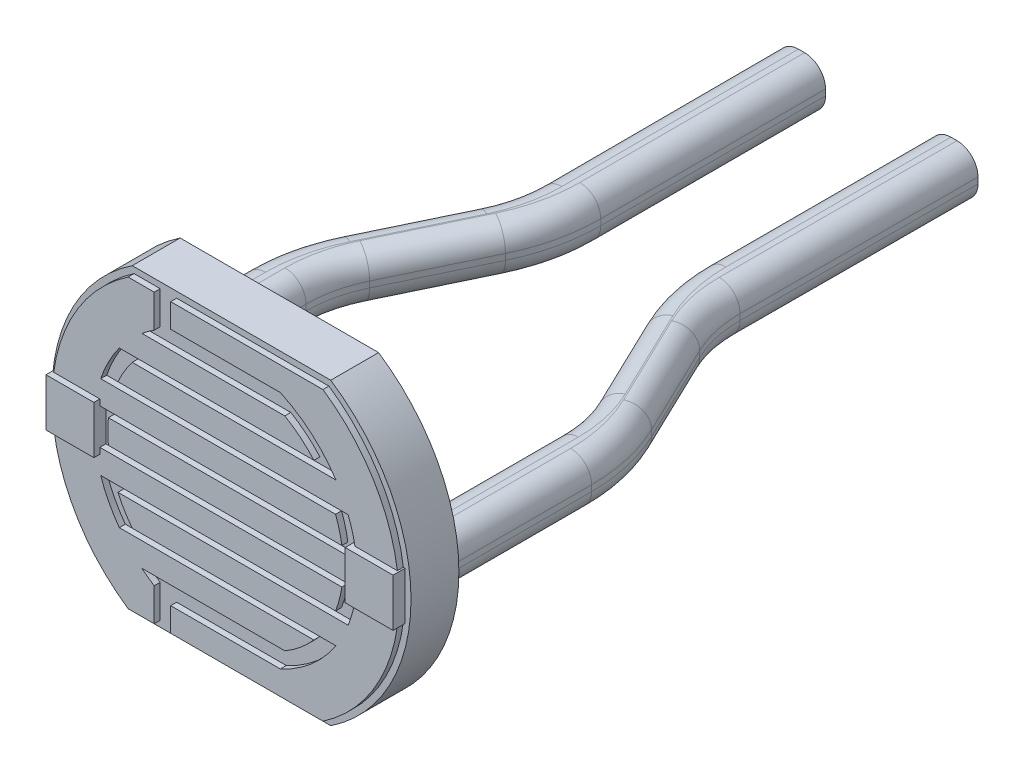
SolidWorks part; units mm, degrees
ref_plane "Face" through (0, 0, 0) normal (0, 0, 1) x (1, 0, 0)
ref_plane "Dessus" through (0, 0, 0) normal (0, 1, 0) x (1, 0, 0)
ref_plane "Droite" through (0, 0, 0) normal (1, 0, 0) x (0, 0, -1)
sketch "Esquisse1" plane through (0, 0, 0) normal (0, 0, 1) x (1, 0, 0)
  line L0 (-6.8062, 2.5) -> (6.6748, 2.5) construction
  line L1 (-7.0691, -2.5) -> (7.2944, -2.5) construction
  line L2 (-1.6583, 2.5) -> (1.6583, 2.5)
  line L3 (-1.6583, -2.5) -> (1.6583, -2.5)
  arc A0 (-1.6583, 2.5) -> (-1.6583, -2.5) centre (0, 0) ccw
  arc A1 (1.6583, -2.5) -> (1.6583, 2.5) centre (0, 0) ccw
extrude "Base-Extrusion" add sketch "Esquisse1" along normal blind 0.8
sketch "Esquisse2" plane through (0, 0, 0.8) normal (0, 0, 1) x (1, 0, 0)
  line L0 (-3.2271, 0) -> (3.4148, 0) construction
  line L1 (-0.9165, -2.4) -> (1.6279, -2.4)
  line L2 (-1.1916, -1.8494) -> (-1.1916, -2.4)
  line L3 (-0.9165, -2) -> (-0.9165, -2.4)
  line L4 (-1.9573, -0.2) -> (2.1909, -0.2)
  line L5 (-1.5592, -1.2) -> (1.8439, -1.2)
  line L6 (0.9165, -2) -> (-0.9165, -2)
  line L7 (0, 2.6012) -> (0, -2.6795) construction
  line L8 (-1.7976, -0.8) -> (2.0494, -0.8)
  line L9 (-1.6279, 2.4) -> (-1.1916, 2.4)
  line L10 (-1.3964, 1.7) -> (0.9906, 1.7)
  line L11 (-2.0857, 0.7) -> (1.8388, 0.7)
  line L12 (-1.7748, 1.3) -> (1.4769, 1.3)
  line L13 (-2.1794, 0.3) -> (1.9445, 0.3)
  line L14 (-1.7976, 0.8) -> (2.0494, 0.8)
  line L15 (0.9165, 2) -> (-0.9165, 2)
  line L16 (-1.5592, 1.2) -> (1.8439, 1.2)
  line L17 (-1.9573, 0.2) -> (2.1909, 0.2)
  line L18 (-0.9165, 2) -> (-0.9165, 2.4)
  line L19 (-1.1916, 1.8494) -> (-1.1916, 2.4)
  line L20 (-0.9165, 2.4) -> (1.6279, 2.4)
  line L21 (-2.1794, -0.3) -> (1.9445, -0.3)
  line L22 (-1.7748, -1.3) -> (1.4769, -1.3)
  line L23 (-2.0857, -0.7) -> (1.8388, -0.7)
  line L24 (-1.3964, -1.7) -> (0.9906, -1.7)
  line L25 (-1.6279, -2.4) -> (-1.1916, -2.4)
  arc A0 (-1.7748, 1.3) -> (-2.0857, 0.7) centre (0, 0) ccw
  arc A1 (1.6279, -2.4) -> (1.6279, 2.4) centre (0, 0) ccw
  arc A2 (1.4769, 1.3) -> (0.9906, 1.7) centre (0, 0) ccw
  arc A3 (-1.6279, 2.4) -> (-1.6279, -2.4) centre (0, 0) ccw
  arc A4 (-1.5592, 1.2) -> (-1.7976, 0.8) centre (0, 0) ccw
  arc A5 (-2.1794, 0.3) -> (-2.1794, -0.3) centre (0, 0) ccw
  arc A6 (-1.9573, 0.2) -> (-1.9573, -0.2) centre (0, 0) ccw
  arc A7 (1.9445, 0.3) -> (1.8388, 0.7) centre (0, 0) ccw
  arc A8 (2.1909, 0.2) -> (2.0494, 0.8) centre (0, 0) ccw
  arc A9 (1.8439, 1.2) -> (0.9165, 2) centre (0, 0) ccw
  arc A10 (-1.1916, 1.8494) -> (-1.3964, 1.7) centre (0, 0) ccw
  arc A11 (-1.1916, -1.8494) -> (-1.3964, -1.7) centre (0, 0) cw
  arc A12 (1.8439, -1.2) -> (0.9165, -2) centre (0, 0) cw
  arc A13 (2.1909, -0.2) -> (2.0494, -0.8) centre (0, 0) cw
  arc A14 (1.9445, -0.3) -> (1.8388, -0.7) centre (0, 0) cw
  arc A15 (-1.5592, -1.2) -> (-1.7976, -0.8) centre (0, 0) cw
  arc A16 (1.4769, -1.3) -> (0.9906, -1.7) centre (0, 0) cw
  arc A17 (-1.7748, -1.3) -> (-2.0857, -0.7) centre (0, 0) cw
extrude "Boss.-Extru.1" add sketch "Esquisse2" along normal blind 0.1
sketch "Esquisse3" plane through (0, 0, 0.9) normal (0, 0, 1) x (1, 0, 0)
  line L0 (-3.3095, 0) -> (3.2082, 0) construction
  line L1 (-2.5, 1.2948) -> (-2.5, -1.1429) construction
  line L2 (2.5, 1.2948) -> (2.5, -1.1429) construction
  line L3 (-3.1199, 0.4) -> (3.3024, 0.4) construction
  line L4 (-3.1199, -0.4) -> (3.3024, -0.4) construction
  line L5 (0, 1.0993) -> (0, -1.2) construction
  line L6 (-2.1, 0.9496) -> (-2.1, -0.8314) construction
  line L7 (-2.9, 0.6738) -> (-2.9, -0.8314) construction
  line L8 (2.1, 0.4) -> (2.1, -0.4)
  line L9 (-2.9, 0.4) -> (-2.1, 0.4)
  line L10 (-2.9, 0.4) -> (-2.9, -0.4)
  line L11 (-2.9, -0.4) -> (-2.1, -0.4)
  line L12 (-2.1, 0.4) -> (-2.1, -0.4)
  line L13 (2.9, -0.4) -> (2.1, -0.4)
  line L14 (2.9, 0.4) -> (2.9, -0.4)
  line L15 (2.9, 0.4) -> (2.1, 0.4)
sketch "Esquisse11" plane through (0, 0, 0) normal (0, 1, 0) x (1, 0, 0)
  line L0 (-2.5, 1.1688) -> (-2.5, -1.6691) construction
  line L1 (-1.27, 11.2472) -> (-1.27, -2.348) construction
  line L2 (-4.4046, 3) -> (4.5964, 3) construction
  line L3 (-4.2885, 5) -> (5.6407, 5) construction
  line L4 (-4.8044, 10) -> (5.9198, 10) construction
  line L5 (-3.523, -1) -> (4.0722, -1) construction
  line L6 (-1.6751, 10) -> (-0.8726, 10)
  line L7 (-2.9, -1) -> (-2.1, -1)
  line L8 (0, 10.5865) -> (0, -2.6445) construction
  line L9 (-0.8716, 6.2426) -> (-0.8726, 10)
  line L10 (-2.6046, 3.6155) -> (-1.8614, 5.1637)
  line L11 (-2.1, -1) -> (-2.1, 2.5449)
  line L12 (-1.6645, 6.0345) -> (-1.6751, 10)
  line L13 (-1.903, 3.4103) -> (-1.1671, 4.9436)
  line L14 (-2.9, -1) -> (-2.9, 2.3173)
  line L15 (1.6751, 10) -> (0.8726, 10)
  line L16 (0.8716, 6.2426) -> (0.8726, 10)
  line L17 (1.6645, 6.0345) -> (1.6751, 10)
  line L18 (1.903, 3.4103) -> (1.1671, 4.9436)
  line L19 (2.6046, 3.6155) -> (1.8614, 5.1637)
  line L20 (2.9, -1) -> (2.9, 2.3173)
  line L21 (2.9, -1) -> (2.1, -1)
  line L22 (2.1, -1) -> (2.1, 2.5449)
  line L23 (-1.67, 11.2472) -> (-1.67, 4.1378) construction
  line L24 (-0.87, 11.2472) -> (-0.87, 3.6622) construction
  arc A0 (-1.903, 3.4103) -> (-2.1, 2.5449) centre (-0.1, 2.5449) ccw
  arc A1 (-1.6645, 6.0345) -> (-1.8614, 5.1637) centre (-3.6645, 6.0291) cw
  arc A2 (-0.8716, 6.2426) -> (-1.1671, 4.9436) centre (-3.8716, 6.2418) cw
  arc A3 (-2.6046, 3.6155) -> (-2.9, 2.3173) centre (0.1, 2.3173) ccw
  arc A4 (0.8716, 6.2426) -> (1.1671, 4.9436) centre (3.8716, 6.2418) ccw
  arc A5 (1.6645, 6.0345) -> (1.8614, 5.1637) centre (3.6645, 6.0291) ccw
  arc A6 (1.903, 3.4103) -> (2.1, 2.5449) centre (0.1, 2.5449) cw
  arc A7 (2.6046, 3.6155) -> (2.9, 2.3173) centre (-0.1, 2.3173) cw
  dimension "D1" = 1.27
  dimension "D4" = 2
  dimension "D5" = 3
  dimension "D2" = 0.4
  dimension "D3" = 0.8
extrude "Boss.-Extru.2" add sketch "Esquisse11" along normal mid plane 0.8
fillet "Congé1" radius 0.35 40 edges at (-2.9, -0.4, -1.1586) (-2.1, -0.4, -1.2724) (-2.1, 0.4, -1.2724) (-2.0501, 0.4, -2.9887) (-1.5351, 0.4, -4.177) (-0.9463, 0.4, -5.5765) (-0.8721, 0.4, -8.1213) (-1.6698, 0.4, -8.0172) (-1.7137, 0.4, -5.588) (-2.233, 0.4, -4.3896) (-2.8252, 0.4, -2.983) (-2.9, 0.4, -1.1586) (-2.0501, -0.4, -2.9887) (-1.5351, -0.4, -4.177) (-0.9463, -0.4, -5.5765) (-0.8721, -0.4, -8.1213) (-1.6698, -0.4, -8.0172) (-1.7137, -0.4, -5.588) (-2.233, -0.4, -4.3896) (-2.8252, -0.4, -2.983) (2.1, -0.4, -1.2724) (2.9, -0.4, -1.1586) (2.9, 0.4, -1.1586) (2.8252, 0.4, -2.983) (2.233, 0.4, -4.3896) (1.7137, 0.4, -5.588) (1.6698, 0.4, -8.0172) (0.8721, 0.4, -8.1213) (0.9463, 0.4, -5.5765) (1.5351, 0.4, -4.177) (2.0501, 0.4, -2.9887) (2.1, 0.4, -1.2724) (1.6698, -0.4, -8.0172) (0.8721, -0.4, -8.1213) (0.9463, -0.4, -5.5765) (1.5351, -0.4, -4.177) (2.0501, -0.4, -2.9887) (2.8252, -0.4, -2.983) (2.233, -0.4, -4.3896) (1.7137, -0.4, -5.588)
